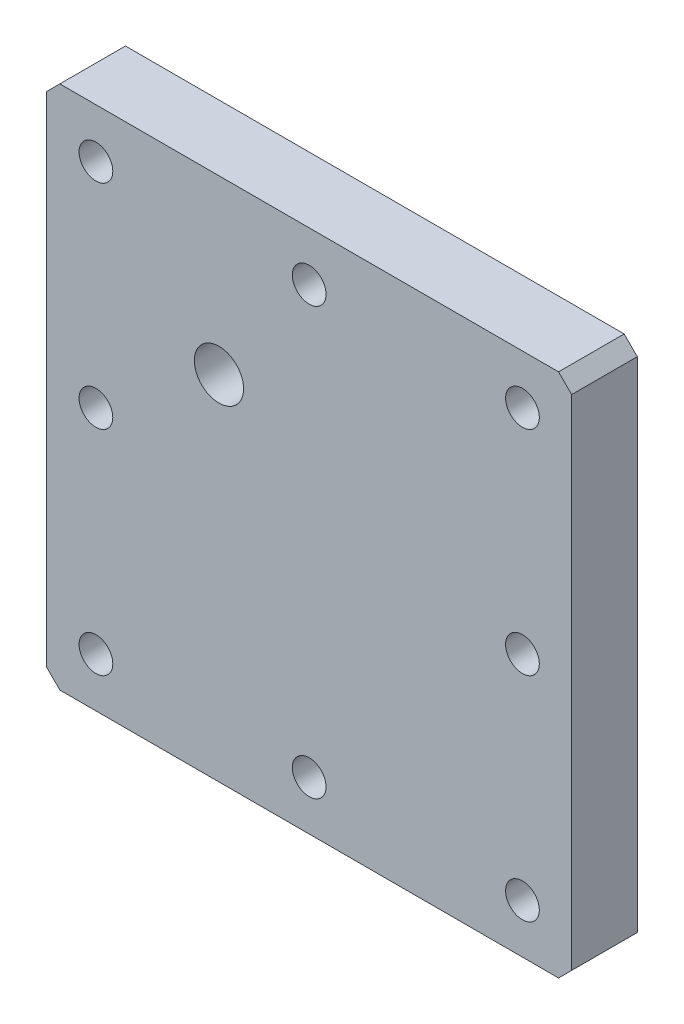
SolidWorks part; units mm, degrees
ref_plane "Front Plane" through (0, 0, 0) normal (0, 0, 1) x (1, 0, 0)
ref_plane "Top Plane" through (0, 0, 0) normal (0, 1, 0) x (1, 0, 0)
ref_plane "Right Plane" through (0, 0, 0) normal (1, 0, 0) x (0, 0, -1)
sketch "Sketch1" plane through (0, 0, 0) normal (0, 0, 1) x (1, 0, 0)
  line L0 (-50.8, 48.26) -> (-48.26, 50.8)
  line L1 (-48.26, -50.8) -> (48.26, -50.8)
  line L2 (-50.8, -48.26) -> (-50.8, 48.26)
  line L3 (-48.26, 50.8) -> (48.26, 50.8)
  line L4 (50.8, -48.26) -> (50.8, 48.26)
  line L5 (-50.8, -50.8) -> (50.8, 50.8) construction
  line L6 (-50.8, 50.8) -> (50.8, -50.8) construction
  line L7 (48.26, 50.8) -> (50.8, 48.26)
  line L8 (48.26, -50.8) -> (50.8, -48.26)
  line L9 (-50.8, -48.26) -> (-48.26, -50.8)
  line L10 (-41.275, 41.275) -> (0, 41.275)
  line L11 (41.275, -41.275) -> (-41.275, -41.275) construction
  line L12 (41.275, -41.275) -> (41.275, 41.275) construction
  line L13 (41.275, 41.275) -> (-41.275, 41.275) construction
  line L14 (-41.275, -41.275) -> (-41.275, 41.275) construction
  line L15 (41.275, -41.275) -> (-41.275, 41.275) construction
  line L16 (41.275, 41.275) -> (-41.275, -41.275) construction
  line L17 (41.275, -41.275) -> (0, -41.275)
  line L18 (-34.925, 34.925) -> (0, 0)
  line L19 (-34.925, -34.925) -> (34.925, -34.925)
  line L20 (-34.925, -34.925) -> (-34.925, 34.925)
  line L21 (-34.925, 34.925) -> (34.925, 34.925)
  line L22 (34.925, -34.925) -> (34.925, 34.925)
  line L23 (-34.925, -34.925) -> (34.925, 34.925) construction
  line L24 (-34.925, 34.925) -> (34.925, -34.925) construction
  line L25 (-17.4625, 17.4625) -> (-50.8, 17.4625) construction
  line L26 (-17.4625, 17.4625) -> (-17.4625, 50.8) construction
  circle A0 centre (-41.275, 41.275) radius 3.2639
  circle A1 centre (0, 41.275) radius 3.2639
  circle A2 centre (41.275, 41.275) radius 3.2639
  circle A3 centre (41.275, 0) radius 3.2639
  circle A4 centre (41.275, -41.275) radius 3.2639
  circle A5 centre (0, -41.275) radius 3.2639
  circle A6 centre (-41.275, -41.275) radius 3.2639
  circle A7 centre (-41.275, 0) radius 3.2639
  circle A10 centre (-17.4625, 17.4625) radius 4.7625
  point P0 (0, 0)
  point P14 (0, 0)
  point P35 (0, 0)
  dimension "D5" = 6.5278
  dimension "D6" = 69.85
  dimension "D8" = 9.525
  dimension "D1" = 101.6
  dimension "D2" = 101.6
  dimension "D3" = 82.55
  dimension "D4" = 82.55
  dimension "D7" = 69.85
  dimension "D13" = 33.3375
extrude "Boss-Extrude1" add sketch "Sketch1" along normal blind 12.7
